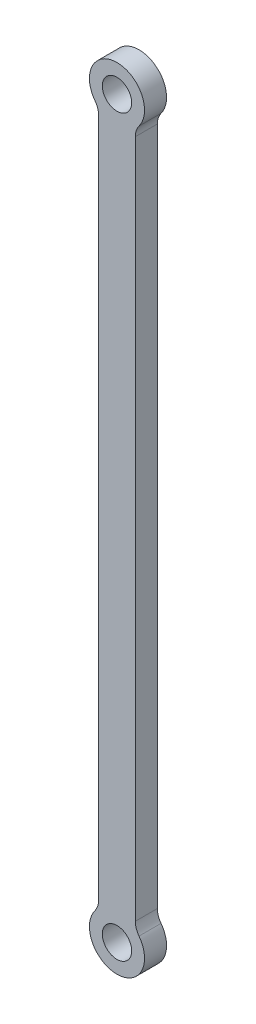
SolidWorks part; units mm, degrees
ref_plane "Alzado" through (0, 0, 0) normal (0, 0, 1) x (1, 0, 0)
ref_plane "Planta" through (0, 0, 0) normal (0, 1, 0) x (1, 0, 0)
ref_plane "Vista lateral" through (0, 0, 0) normal (1, 0, 0) x (0, 0, -1)
sketch "Croquis1" plane through (0, 0, 0) normal (0, 0, 1) x (1, 0, 0)
  line L0 (0, 0) -> (0, 200) construction
  line L3 (5, 7.5) -> (5, 192.5)
  line L6 (-5, 7.5) -> (-5, 192.5)
  circle A2 centre (0, 0) radius 4
  arc A4 (-6, 4.5) -> (6, 4.5) centre (0, 0) ccw
  arc A5 (6, 4.5) -> (5, 7.5) centre (10, 7.5) cw
  arc A8 (-6, 4.5) -> (-5, 7.5) centre (-10, 7.5) ccw
  arc A10 (0, 7.5) -> (-6, 4.5) centre (0, 0) ccw construction
  arc A11 (6, 4.5) -> (0, 7.5) centre (0, 0) ccw construction
  arc A12 (6, 195.5) -> (-6, 195.5) centre (0, 200) ccw
  circle A13 centre (0, 200) radius 4
  arc A14 (5, 192.5) -> (6, 195.5) centre (10, 192.5) cw
  arc A16 (-5, 192.5) -> (-6, 195.5) centre (-10, 192.5) ccw
  dimension "D1" = 200
  dimension "D3" = 15
  dimension "D4" = 8
  dimension "D5" = 5
  dimension "D6" = 5
  dimension "D2" = 15
extrude "Saliente-Extruir1" add sketch "Croquis1" along normal blind 6 contours L6 A8 A4 A5 L3
sketch "Croquis2" plane through (0, 0, 6) normal (0, 0, 1) x (1, 0, 0)
  line L0 (0, 0) -> (0, 200) construction
  circle A0 centre (0, 0) radius 4 construction
  circle A1 centre (0, 200) radius 4 construction
